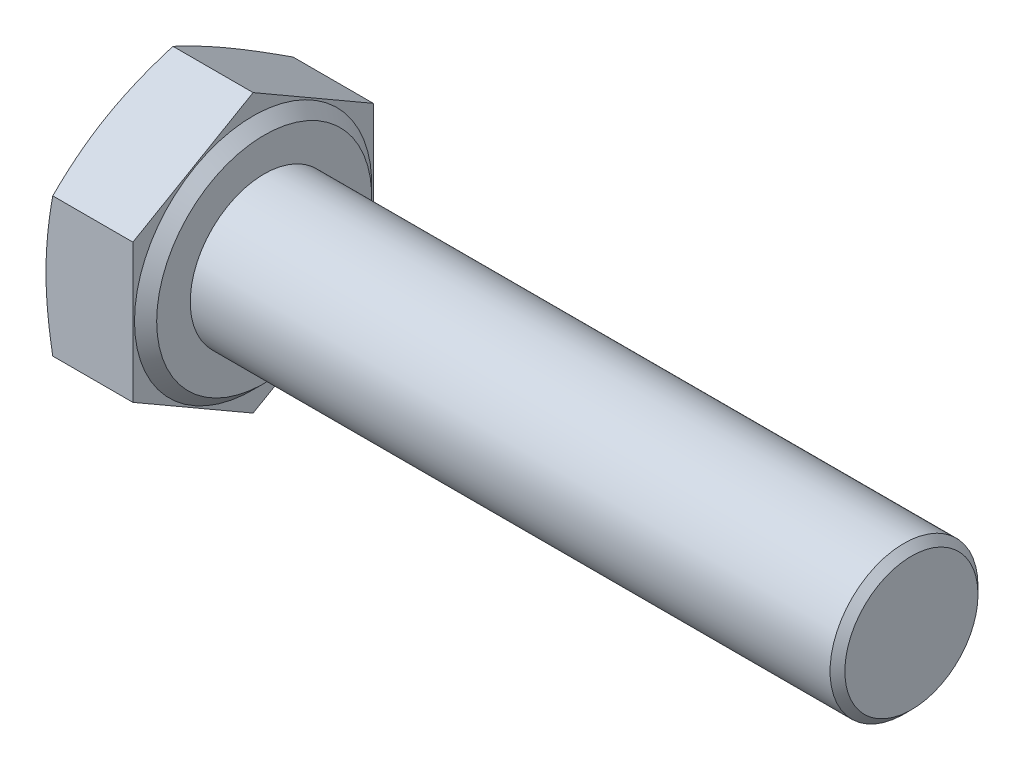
SolidWorks part; units mm, degrees
ref_plane "Front" through (0, 0, 0) normal (0, 0, 1) x (1, 0, 0)
ref_plane "Top" through (0, 0, 0) normal (0, 1, 0) x (1, 0, 0)
ref_plane "Right" through (0, 0, 0) normal (1, 0, 0) x (0, 0, -1)
sketch "Sketch2" plane through (0, 0, 0) normal (1, 0, 0) x (0, 0, -1)
  line L1 (6.5, -3.7528) -> (6.5, 3.7528)
  line L2 (6.5, 3.7528) -> (0, 7.5056)
  line L3 (0, 7.5056) -> (-6.5, 3.7528)
  line L4 (-6.5, 3.7528) -> (-6.5, -3.7528)
  line L5 (-6.5, -3.7528) -> (0, -7.5056)
  line L6 (0, -7.5056) -> (6.5, -3.7528)
  circle A0 centre (0, 0) radius 6.5 construction
  dimension "s" = 13
extrude "BaseHead" add sketch "Sketch2" along normal blind 5.3
sketch "Sketch3" plane through (0, 0, 0) normal (0, 0, 1) x (1, 0, 0)
  line L0 (5.3, 7.5056) -> (5.3, 5.815)
  line L2 (5.3, 5.815) -> (4.7, 6.415)
  line L3 (4.7, 6.415) -> (4.7, 7.5056)
  line L5 (4.7, 7.5056) -> (5.3, 7.5056)
  line L6 (-0.9571, 0) -> (7.6478, 0) construction
  line L7 (5.3, 7.5056) -> (0, 7.5056) construction
  dimension "D1" = 45
  dimension "c" = 0.6
  dimension "Dw" = 11.63
revolve "BearingFace" cut sketch "Sketch3" angle 360 about L6
sketch "Sketch4" plane through (0, 0, 0) normal (0, 0, 1) x (1, 0, 0)
  line L0 (-0.4935, 0) -> (3.5626, 0) construction
  line L2 (0, 7.5056) -> (0.366, 7.5056)
  line L4 (0.366, 7.5056) -> (0, 6.5)
  line L6 (0, 6.5) -> (0, 7.5056)
  line L7 (4.7, 7.5056) -> (0, 7.5056) construction
  dimension "D1" = 20
  dimension "D2" = 13
revolve "HeadChamfer" cut sketch "Sketch4" angle 360 about L0
sketch "Sketch5" plane through (5.3, 0, 0) normal (1, 0, 0) x (0, 0, -1)
  circle A0 centre (0, 0) radius 4
  dimension "d" = 8
extrude "BaseBody" add sketch "Sketch5" along normal blind 35
chamfer "Chamfer1" distance 0.4 angle 45 1 edges at (40.3, 0, -4)
fillet "HeadFillet" [suppressed] radius 0.4
sketch "Sketch6" plane through (0, 0, 0) normal (0, 0, 1) x (1, 0, 0)
  line L0 (5.3, 4.5) -> (5.8, 4.5)
  line L1 (5.8, 4.5) -> (5.8, 4)
  line L2 (5.8, 4) -> (5.55, 3.567)
  line L3 (5.55, 3.567) -> (5.3, 4)
  line L4 (5.3, 4) -> (5.3, 4.5)
  line L5 (39.9, 4) -> (5.3, 4) construction
  line L6 (5.3, -5.815) -> (5.3, 5.815) construction
  dimension "D1" = 0.5
revolve "Cut-Revolve10" [suppressed] cut sketch "Sketch6" angle 360 about axis through (-0.9571, 0, 0) along (1, 0, 0)
pattern_linear "LPattern10" [suppressed] count 58
equation "\"D2@Sketch4\" = \"s@Sketch2\""
equation "\"D1@Chamfer1\" = 0.05 * \"d@Sketch5\""
equation "\"D1@Sketch6\" =  ( \"d@Sketch5\" - \"D2@ThreadCosmetic1\" )  / 2"
equation "\"pitch@LPattern10\" = \"D1@Sketch6\" * 1.2"
equation "\"D1@LPattern10\" = \"l@BaseBody\" / \"pitch@LPattern10\""
